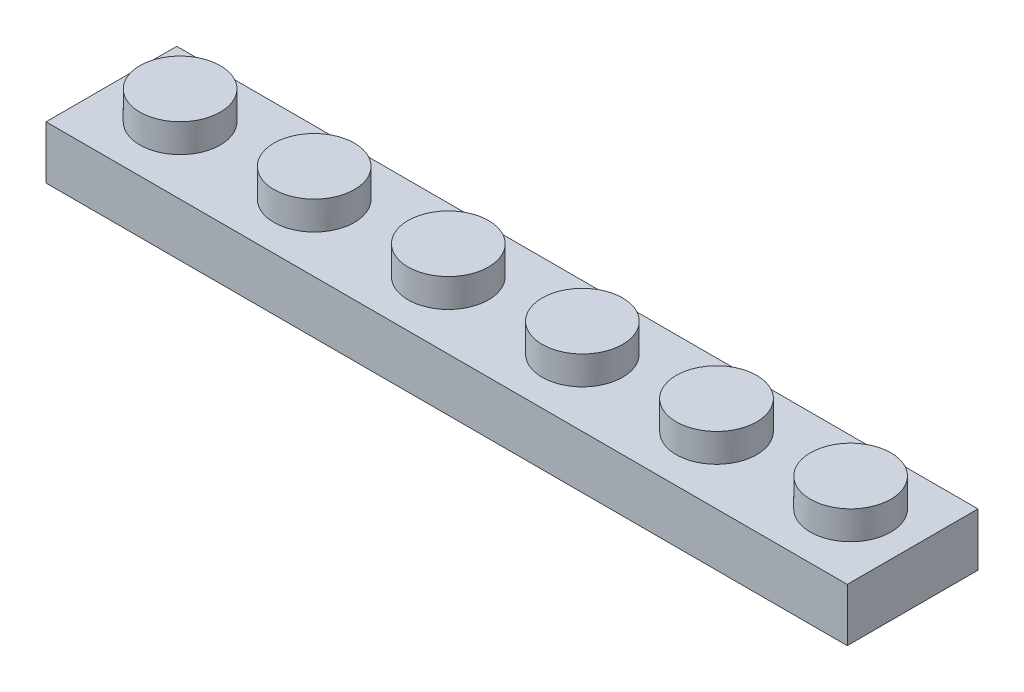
SolidWorks part; units mm, degrees
ref_plane "Front Plane" through (0, 0, 0) normal (0, 0, 1) x (1, 0, 0)
ref_plane "Top Plane" through (0, 0, 0) normal (0, 1, 0) x (1, 0, 0)
ref_plane "Right Plane" through (0, 0, 0) normal (1, 0, 0) x (0, 0, -1)
sketch "Sketch1" plane through (0, 0, 0) normal (0, 1, 0) x (1, 0, 0)
  line L1 (0, 0) -> (47.8, 0)
  line L2 (0, 0) -> (0, 7.8)
  line L3 (0, 7.8) -> (47.8, 7.8)
  line L4 (47.8, 0) -> (47.8, 7.8)
  dimension "D1" = 47.8
  dimension "D2" = 7.8
extrude "Extrude1" add sketch "Sketch1" along normal blind 3.166
sketch "Sketch2" plane through (0, 3.166, 0) normal (0, 1, 0) x (1, 0, 0)
  circle A0 centre (4, 4) radius 2.4
  point P6 (9.3567, 6.1688)
  dimension "D1" = 4.8
extrude "Extrude2" add sketch "Sketch2" along normal blind 1.7
sketch "Sketch3" plane through (0, 0, 0) normal (0, -1, 0) x (1, 0, 0)
  line L0 (47.8, 0) -> (47.8, -7.8) construction
  line L1 (41.55, -1.55) -> (46.35, -1.55)
  line L2 (41.55, -1.55) -> (41.55, -6.35)
  line L3 (41.55, -6.35) -> (46.35, -6.35)
  line L4 (46.35, -1.55) -> (46.35, -6.35)
  line L5 (47.8, -7.8) -> (0, -7.8) construction
  dimension "D1" = 4.8
  dimension "D2" = 1.45
  dimension "D3" = 1.45
extrude "Extrude3" cut sketch "Sketch3" against normal blind 1.8
sketch "Sketch4" plane through (0, 3.166, 0) normal (0, 1, 0) x (1, 0, 0)
  line L0 (0, 3.9) -> (49.6177, 3.9) construction
  line L1 (0, 7.8) -> (0, 0) construction
pattern_linear "LPattern1" count 6 spacing 8 along (1, 0, 0) of "Extrude2"
pattern_linear "LPattern2" count 6 spacing 8 along (-1, 0, 0) of "Extrude3"
